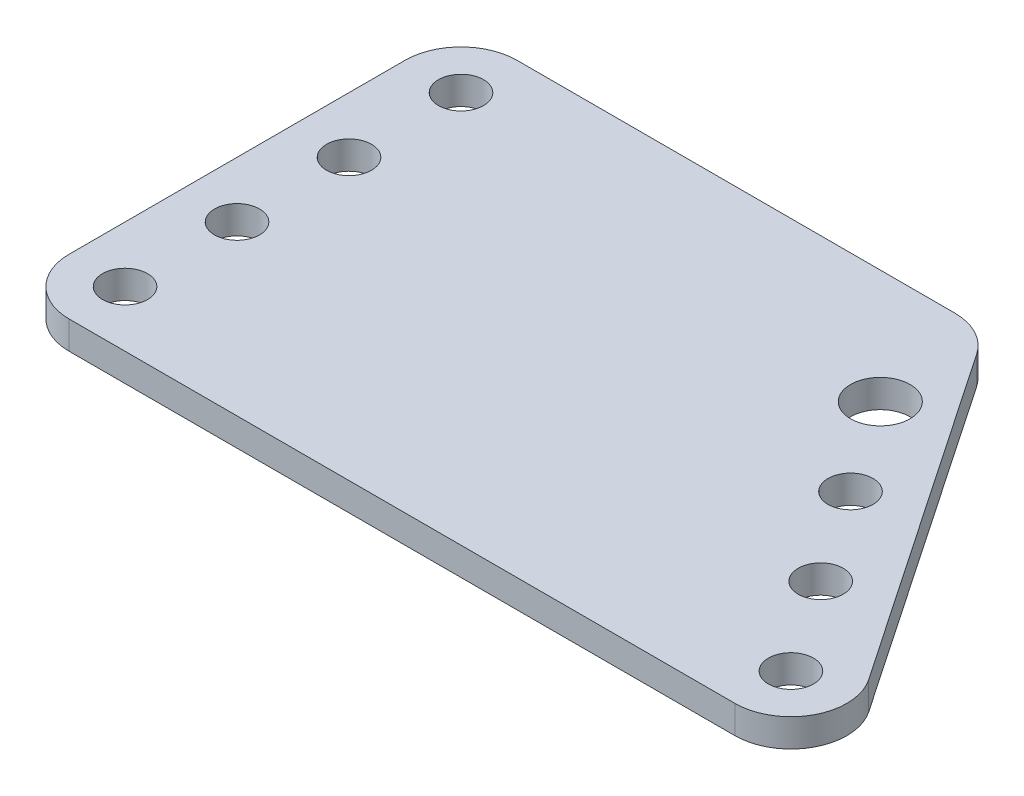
SolidWorks part; units mm, degrees
ref_plane "Front Plane" through (0, 0, 0) normal (0, 0, 1) x (1, 0, 0)
ref_plane "Top Plane" through (0, 0, 0) normal (0, 1, 0) x (1, 0, 0)
ref_plane "Right Plane" through (0, 0, 0) normal (1, 0, 0) x (0, 0, -1)
sketch "Sketch1" plane through (0, 0, 0) normal (0, 1, 0) x (1, 0, 0)
  line L0 (6.35, 0) -> (81.8642, 0)
  line L1 (87.1188, 9.9154) -> (61.2669, 48.0154)
  line L2 (56.0123, 50.8) -> (6.35, 50.8)
  line L3 (0, 44.45) -> (0, 6.35)
  arc A0 (6.35, 0) -> (0, 6.35) centre (6.35, 6.35) cw
  arc A1 (6.35, 50.8) -> (0, 44.45) centre (6.35, 44.45) ccw
  arc A2 (61.2669, 48.0154) -> (56.0123, 50.8) centre (56.0123, 44.45) ccw
  arc A3 (81.8642, 0) -> (87.1188, 9.9154) centre (81.8642, 6.35) ccw
  point P7 (0, 0)
  point P10 (0, 50.8)
  dimension "D2" = 6.35
  dimension "D1" = 50.8
  dimension "D3" = 34.158
  dimension "D4" = 75.5142
extrude "Boss-Extrude1" add sketch "Sketch1" along normal blind 3.175
hole_wizard "#7 (0.201) Diameter Hole1" positions "Sketch2" profile "Sketch3" hole size "#7" standard "ANSI Inch"
sketch "Sketch2" plane through (0, 3.175, 0) normal (0, 1, 0) x (1, 0, 0)
  line L0 (6.35, 44.45) -> (6.35, 6.35) construction
  line L2 (60.4719, 37.8775) -> (81.8642, 6.35) construction
  line L4 (87.1188, 9.9154) -> (61.2669, 48.0154) construction
  line L5 (6.35, 0) -> (81.8642, 0) construction
  line L6 (56.0123, 50.8) -> (6.35, 50.8) construction
  line L7 (0, 44.45) -> (0, 6.35) construction
  point P1 (6.35, 44.45)
  point P2 (6.35, 6.35)
  point P5 (60.4719, 37.8775)
  point P6 (81.8642, 6.35)
  point P37 (6.35, 19.05)
  point P39 (6.35, 31.75)
  point P45 (67.6027, 27.3683)
  point P47 (74.7334, 16.8592)
  dimension "D1" = 6.35
  dimension "D2" = 6.35
  dimension "D3" = 6.35
  dimension "D4" = 6.35
  dimension "D5" = 6.35
  dimension "D6" = 38.1
  dimension "D7" = 12.7
  dimension "D8" = 12.7
  dimension "D9" = 12.7
  dimension "D10" = 12.7
sketch "Sketch3" plane through (6.35, 3.175, -44.45) normal (1, 0, 0) x (0, 0, 1)
  line L0 (0, 0) -> (0, 3.175)
  line L1 (0, 3.175) -> (2.5527, 3.175)
  line L2 (2.5527, 3.175) -> (2.5527, 0)
  line L5 (2.5527, 0) -> (0, 0)
  line L11 (0, -6.35) -> (0, 107.95) construction
  dimension "Thru Hole Dia." = 5.1054
  dimension "Thru Hole Depth" = 3.175
hole_wizard "17/64 (0.26563) Diameter Hole1" positions "Sketch5" profile "Sketch6" hole size "17/64" standard "ANSI Inch"
sketch "Sketch5" plane through (0, 3.175, 0) normal (0, 1, 0) x (1, 0, 0)
  point P0 (60.4719, 37.8775)
sketch "Sketch6" plane through (60.4719, 3.175, -37.8775) normal (1, 0, 0) x (0, 0, 1)
  line L0 (0, 0) -> (0, 3.175)
  line L1 (0, 3.175) -> (3.3735, 3.175)
  line L2 (3.3735, 3.175) -> (3.3735, 0)
  line L5 (3.3735, 0) -> (0, 0)
  line L11 (0, -6.35) -> (0, 107.95) construction
  dimension "Thru Hole Dia." = 6.747
  dimension "Thru Hole Depth" = 3.175
